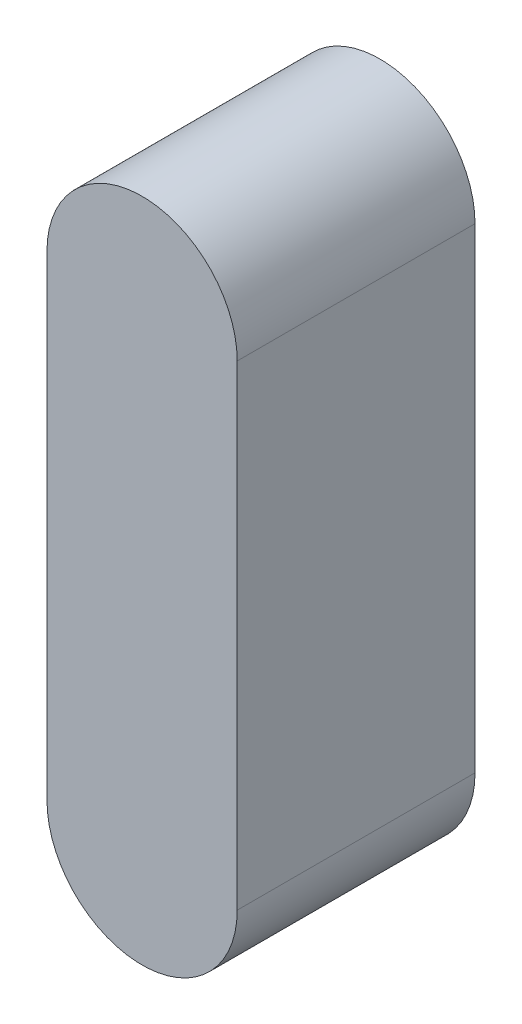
SolidWorks part; units mm, degrees
ref_plane "前视基准面" through (0, 0, 0) normal (0, 0, 1) x (1, 0, 0)
ref_plane "上视基准面" through (0, 0, 0) normal (0, 1, 0) x (1, 0, 0)
ref_plane "右视基准面" through (0, 0, 0) normal (1, 0, 0) x (0, 0, -1)
sketch "草图2" plane through (0, 0, 0) normal (0, 0, 1) x (1, 0, 0)
  line L0 (2, 78) -> (2, 88) construction
  line L1 (-2, 88) -> (-2, 78) construction
  line L2 (2, 78) -> (2, 88)
  line L3 (-2, 88) -> (-2, 78)
  arc A0 (-2, 78) -> (2, 78) centre (0, 78) ccw construction
  arc A1 (2, 88) -> (-2, 88) centre (0, 88) ccw construction
  arc A2 (-2, 78) -> (2, 78) centre (0, 78) ccw
  arc A3 (2, 88) -> (-2, 88) centre (0, 88) ccw
extrude "拉伸1" add sketch "草图2" along normal blind 5
